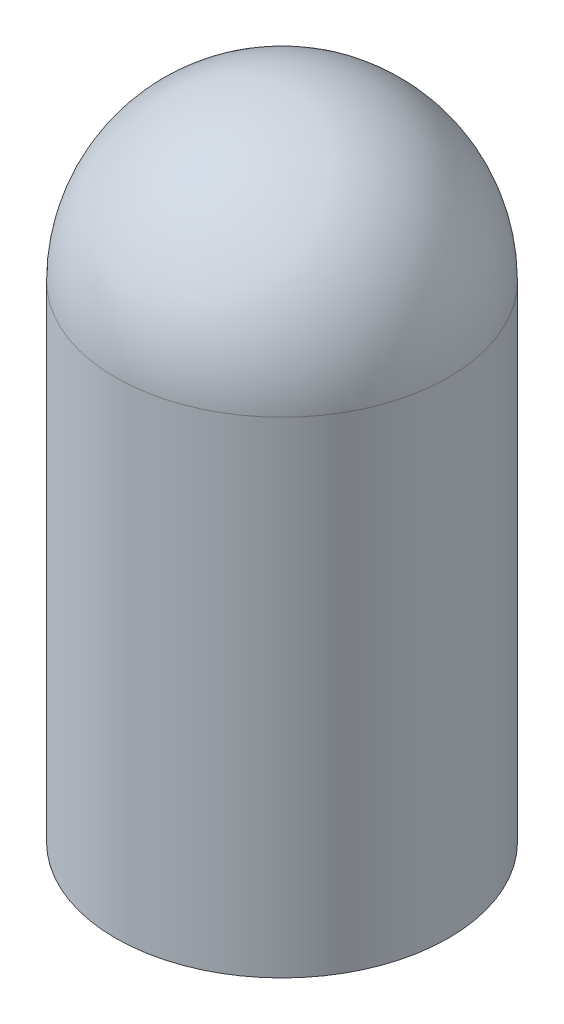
SolidWorks part; units mm, degrees
ref_plane "Front Plane" through (0, 0, 0) normal (0, 0, 1) x (1, 0, 0)
ref_plane "Top Plane" through (0, 0, 0) normal (0, 1, 0) x (1, 0, 0)
ref_plane "Right Plane" through (0, 0, 0) normal (1, 0, 0) x (0, 0, -1)
sketch "Sketch3" plane through (0, 0, 0) normal (0, 0, 1) x (1, 0, 0)
  line L0 (0, 0) -> (0, -26741.5197) construction
  line L1 (0, 0) -> (26741.5197, 0) construction
  line L2 (-12, 0) -> (-12, 35)
  line L3 (-10.5, 0) -> (-10.5, 35)
  line L4 (0, 47) -> (0, 45.5)
  line L5 (-10.5, 0) -> (-12, 0)
  arc A0 (-10.5, 35) -> (0, 45.5) centre (0, 35) cw
  arc A1 (-12, 35) -> (0, 47) centre (0, 35) cw
  dimension "D2" = 10.5
  dimension "D3" = 12
  dimension "D1" = 35
revolve "Revolve1" add sketch "Sketch3" angle 360 about L0
